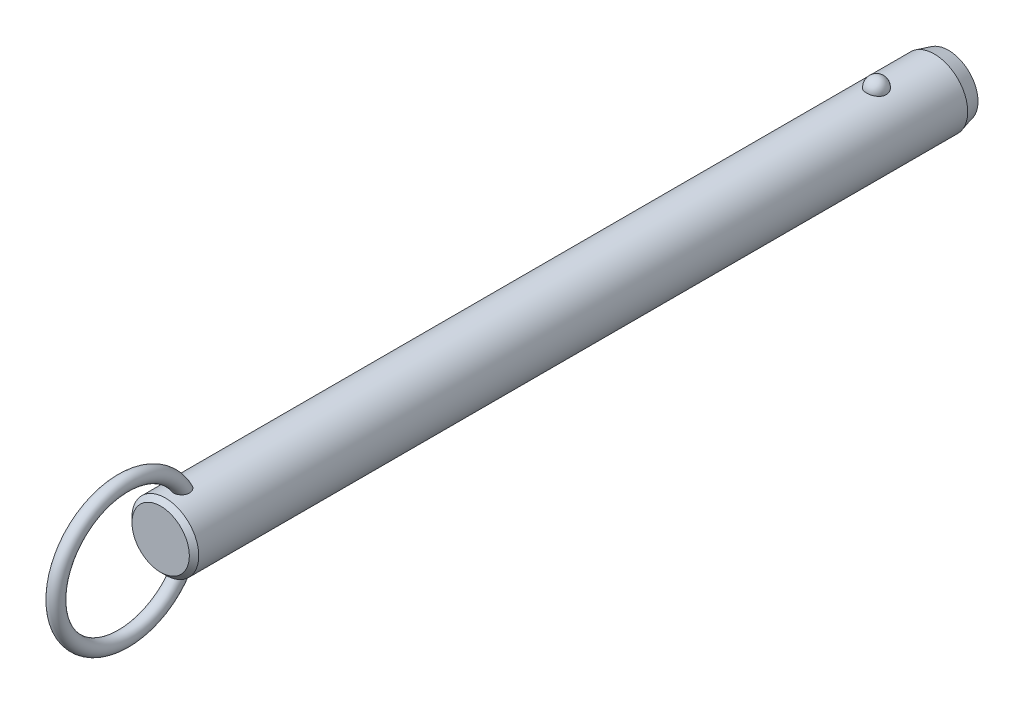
SolidWorks part; units mm, degrees
ref_plane "Front Plane" through (0, 0, 0) normal (0, 0, 1) x (1, 0, 0)
ref_plane "Top Plane" through (0, 0, 0) normal (0, 1, 0) x (1, 0, 0)
ref_plane "Right Plane" through (0, 0, 0) normal (1, 0, 0) x (0, 0, -1)
sketch "Sketch2" plane through (0, 0, 0) normal (0, 0, 1) x (1, 0, 0)
  circle A0 centre (0, 0) radius 7.1
  point P3 (0, 7.1)
  dimension "D1" = 14.2
extrude "Boss-Extrude1" add sketch "Sketch2" along normal blind 142.2
sketch "Sketch3" plane through (0, 0, 0) normal (0, 0, -1) x (-1, 0, 0)
  circle A0 centre (0, 0) radius 7.1
  dimension "D1" = 14.2
extrude "Boss-Extrude2" add sketch "Sketch3" along normal blind 17.4
chamfer "Chamfer1" distance 3 angle 15 1 edges at (-7.1, 0, -17.4)
sketch "Sketch12" plane through (0, 0, 0) normal (1, 0, 0) x (0, 0, -1)
  line L0 (-142.2, 7.1) -> (-142.2, -7.1) construction
  point P0 (-142.2, 0)
sketch "Sketch13" plane through (0, 0, 0) normal (1, 0, 0) x (0, 0, -1)
  circle A0 centre (-158.05, 0) radius 15.85
  point P2 (-142.2, 0)
  dimension "D1" = 31.7
sketch "Sketch14" plane through (0, 0, 0) normal (0, 1, 0) x (1, 0, 0)
  circle A0 centre (0, -143.7) radius 1.5
  point P2 (0, -142.2)
  dimension "D1" = 3
sweep "Sweep1" add profiles "Sketch14" path "Sketch13"
sketch "Sketch15" plane through (0, 0, 142.2) normal (0, 0, 1) x (1, 0, 0)
  circle A0 centre (0, 0) radius 7.1
  dimension "D1" = 14.2
extrude "Boss-Extrude3" add sketch "Sketch15" along normal blind 7.92
chamfer "Chamfer2" distance 1 angle 45 1 edges at (7.1, 0, 150.12)
sketch "Sketch18" plane through (0, 0, 0) normal (1, 0, 0) x (0, 0, -1)
  line L0 (14.4, 7.1) -> (-143.8792, 7.1) construction
  line L1 (2.1, 9.2) -> (2.1, 5)
  line L2 (-143.8792, -7.1) -> (14.4, -7.1) construction
  arc A0 (2.1, 9.2) -> (2.1, 5) centre (2.1, 7.1) ccw
  point P4 (0, 7.1)
  dimension "D1" = 16.3
revolve "Revolve1" add sketch "Sketch18" angle 360 about L1
